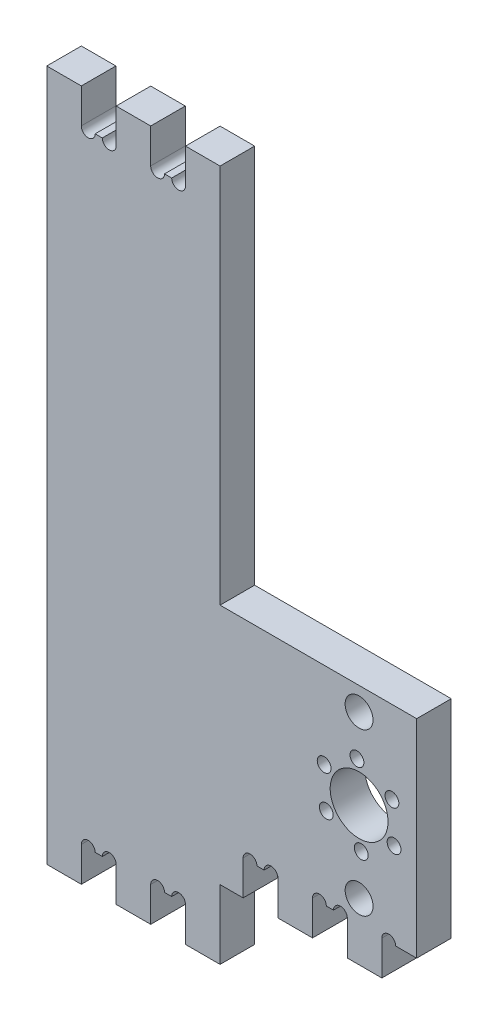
SolidWorks part; units mm, degrees
ref_plane "Ebene vorne" through (0, 0, 0) normal (0, 0, 1) x (1, 0, 0)
ref_plane "Ebene oben" through (0, 0, 0) normal (0, 1, 0) x (1, 0, 0)
ref_plane "Ebene rechts" through (0, 0, 0) normal (1, 0, 0) x (0, 0, -1)
sketch "Skizze1" plane through (0, 0, 0) normal (0, 0, 1) x (1, 0, 0)
  line L0 (14.6793, -15) -> (14.6793, -40)
  line L1 (99.9793, 90) -> (99.9793, 0)
  line L2 (14.6793, -40) -> (14.6793, -45)
  line L3 (14.6793, 90) -> (99.9793, 90)
  line L5 (-60.5207, -40) -> (-60.5207, 160)
  line L6 (14.6793, 240) -> (14.6793, 90)
  line L8 (14.6793, -45) -> (-0.3207, -45)
  line L9 (-0.3207, -45) -> (-0.3207, -30)
  line L10 (-6.3207, -30) -> (-9.4207, -30)
  line L11 (-15.4207, -30) -> (-15.4207, -45)
  line L12 (-15.4207, -45) -> (-30.4207, -45)
  line L13 (-30.4207, -45) -> (-30.4207, -30)
  line L14 (-36.4207, -30) -> (-39.5207, -30)
  line L15 (-45.5207, -30) -> (-45.5207, -45)
  line L16 (99.9793, 0) -> (90.8793, 0)
  line L17 (84.8793, 0) -> (84.8793, -15)
  line L18 (84.8793, -15) -> (69.8793, -15)
  line L19 (69.8793, -15) -> (69.8793, 0)
  line L20 (63.8793, 0) -> (60.7793, 0)
  line L21 (54.7793, 0) -> (54.7793, -15)
  line L22 (54.7793, -15) -> (39.7793, -15)
  line L23 (39.7793, -15) -> (39.7793, 0)
  line L24 (33.7793, 0) -> (30.6793, 0)
  line L25 (24.6793, 0) -> (24.6793, -15)
  line L26 (24.6793, -15) -> (14.6793, -15)
  line L27 (-45.5207, -45) -> (-60.5207, -45)
  line L29 (-60.5207, -45) -> (-60.5207, -40)
  line L30 (-60.5207, 160) -> (-60.5207, 255)
  line L31 (-60.5207, 255) -> (-45.5207, 255)
  line L32 (-45.5207, 255) -> (-45.5207, 240)
  line L33 (-39.5207, 240) -> (-36.4207, 240)
  line L34 (-30.4207, 240) -> (-30.4207, 255)
  line L35 (-30.4207, 255) -> (-15.4207, 255)
  line L36 (-15.4207, 255) -> (-15.4207, 240)
  line L37 (-9.4207, 240) -> (-6.3207, 240)
  line L38 (-0.3207, 240) -> (-0.3207, 255)
  line L39 (-0.3207, 255) -> (14.6793, 255)
  line L40 (14.6793, 255) -> (14.6793, 240)
  arc A0 (-45.5207, -30) -> (-39.5207, -30) centre (-42.5207, -30) cw
  arc A1 (-36.4207, -30) -> (-30.4207, -30) centre (-33.4207, -30) cw
  arc A2 (-15.4207, -30) -> (-9.4207, -30) centre (-12.4207, -30) cw
  arc A3 (-6.3207, -30) -> (-0.3207, -30) centre (-3.3207, -30) cw
  arc A4 (-45.5207, 240) -> (-39.5207, 240) centre (-42.5207, 240) ccw
  arc A5 (-36.4207, 240) -> (-30.4207, 240) centre (-33.4207, 240) ccw
  arc A6 (90.8793, 0) -> (84.8793, 0) centre (87.8793, 0) ccw
  arc A7 (54.7793, 0) -> (60.7793, 0) centre (57.7793, 0) cw
  arc A8 (63.8793, 0) -> (69.8793, 0) centre (66.8793, 0) cw
  arc A9 (24.6793, 0) -> (30.6793, 0) centre (27.6793, 0) cw
  arc A10 (33.7793, 0) -> (39.7793, 0) centre (36.7793, 0) cw
  arc A11 (-15.4207, 240) -> (-9.4207, 240) centre (-12.4207, 240) ccw
  arc A12 (-6.3207, 240) -> (-0.3207, 240) centre (-3.3207, 240) ccw
  dimension "D13" = 3
  dimension "D14" = 3
  dimension "D15" = 3
  dimension "D16" = 3
  dimension "D17" = 3
  dimension "D18" = 3
  dimension "D3" = 10
  dimension "D9" = 15
  dimension "D10" = 15.1
  dimension "D6" = 3
  dimension "D26" = 3
  dimension "D19" = 3
  dimension "D20" = 3
  dimension "D5" = 3
  dimension "D27" = 3
  dimension "D28" = 3
  dimension "D4" = 25
  dimension "D7" = 15.1
  dimension "D8" = 15
  dimension "D11" = 300
  dimension "D12" = 15
  dimension "D21" = 15.1
  dimension "D22" = 15
  dimension "D23" = 15.1
  dimension "D24" = 15
  dimension "D25" = 15.1
  dimension "D29" = 15
  dimension "D30" = 15.1
  dimension "D31" = 15
  dimension "D32" = 15.1
  dimension "D33" = 15
  dimension "D34" = 90
  dimension "D35" = 15
  dimension "D36" = 15
  dimension "D37" = 15
  dimension "D38" = 15
  dimension "D39" = 15
  dimension "D40" = 15
  dimension "D41" = 150
  dimension "D42" = 15
  dimension "D43" = 15
  dimension "D44" = 15
  dimension "D45" = 15
  dimension "D46" = 15
  dimension "D47" = 15
extrude "outline" add sketch "Skizze1" along normal blind 15
sketch "Skizze2" plane through (0, 0, 15) normal (0, 0, 1) x (1, 0, 0)
  line L2 (99.9793, 90) -> (14.6793, 90) construction
  line L4 (99.9793, 0) -> (99.9793, 90) construction
  circle A0 centre (74.9793, 80) radius 6.05
  circle A31 centre (75, 45) radius 12.55
  circle A32 centre (75, 10) radius 6.05
  dimension "D38" = 25.1
  dimension "D39" = 12.1
  dimension "D6" = 12.1
  dimension "D1" = 35
  dimension "D2" = 25
  dimension "D7" = 70
  dimension "D8" = 10
extrude "inner" cut sketch "Skizze2" against normal blind 15 contours A0
sketch "Skizze3" plane through (0, 0, 0) normal (0, 0, -1) x (-1, 0, 0)
  circle A0 centre (-74.0722, 61.9747) radius 3
  circle A1 centre (-59.8356, 52.6838) radius 3
  circle A2 centre (-60.7634, 35.7091) radius 3
  circle A3 centre (-75.9278, 28.0253) radius 3
  circle A4 centre (-90.1644, 37.3162) radius 3
  circle A5 centre (-89.2366, 54.2909) radius 3
  circle A6 centre (-75, 45) radius 12.55 construction
  dimension "D1" = 6
  dimension "D2" = 6
  dimension "D3" = 6
  dimension "D4" = 6
  dimension "D5" = 6
  dimension "D6" = 6
  dimension "D8" = 17
  dimension "D9" = 17
  dimension "D10" = 17
  dimension "D11" = 17
  dimension "D12" = 17
  dimension "D13" = 17
  dimension "D14" = 17
  dimension "D15" = 17
  dimension "D16" = 17
  dimension "D17" = 17
  dimension "D18" = 17
  dimension "D7" = 17
extrude "holes" cut sketch "Skizze3" against normal blind 20
equation "\"R3\"=1.76067"
